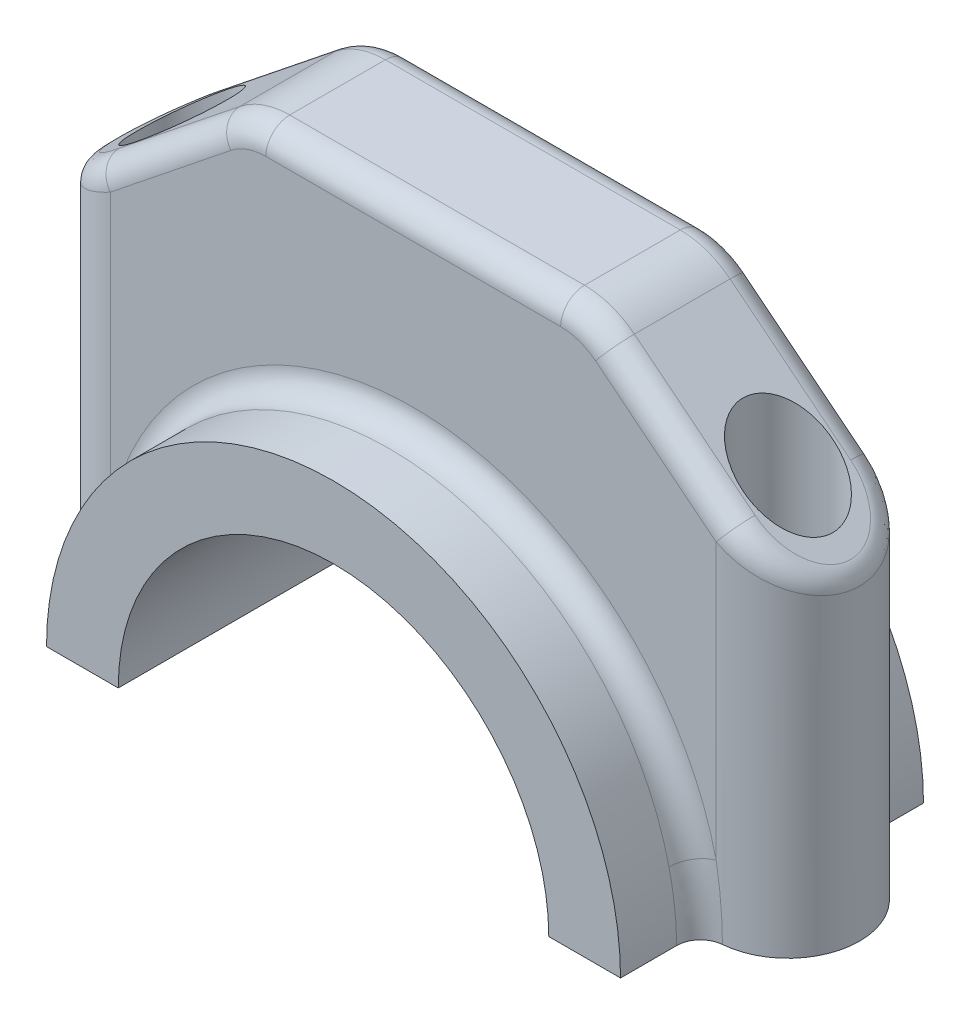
SolidWorks part; units mm, degrees
ref_plane "Front Plane" through (0, 0, 0) normal (0, 0, 1) x (1, 0, 0)
ref_plane "Top Plane" through (0, 0, 0) normal (0, 1, 0) x (1, 0, 0)
ref_plane "Right Plane" through (0, 0, 0) normal (1, 0, 0) x (0, 0, -1)
sketch "Sketch1" plane through (0, 0, 0) normal (0, 0, 1) x (1, 0, 0)
  line L0 (-36, 0) -> (-27, 0)
  line L1 (27, 0) -> (36, 0)
  arc A0 (27, 0) -> (-27, 0) centre (0, 0) ccw
  arc A1 (36, 0) -> (-36, 0) centre (0, 0) ccw
  dimension "D1" = 72
  dimension "D2" = 54
extrude "Boss-Extrude1" add sketch "Sketch1" along normal mid plane 38
ref_plane "Plane1" through (0, 60, 0) normal (0, -1, 0) x (-1, 0, 0)
sketch "Sketch2" plane through (0, 60, 0) normal (0, -1, 0) x (-1, 0, 0)
  line L0 (-38, 0) -> (38, 0) construction
  line L1 (-38, 9) -> (38, 9)
  line L2 (-38, -9) -> (38, -9)
  arc A0 (-38, 9) -> (-38, -9) centre (-38, 0) ccw
  arc A1 (38, -9) -> (38, 9) centre (38, 0) ccw
  point P2 (0, 0)
  dimension "D2" = 9
  dimension "D1" = 76
extrude "Boss-Extrude2" add sketch "Sketch2" along normal up to surface (60 mm away)
sketch "Sketch3" plane through (0, 0, 9) normal (0, 0, 1) x (1, 0, 0)
  line L1 (-27, 0) -> (27, 0)
  line L2 (-27, 0) -> (27, 0)
  arc A1 (27, 0) -> (-27, 0) centre (0, 0) ccw
  arc A2 (27, 0) -> (-27, 0) centre (0, 0) ccw
  dimension "D1" = 0
extrude "Cut-Extrude1" cut sketch "Sketch3" against normal through all both and the other way through all
sketch "Sketch5" plane through (0, 60, 0) normal (0, -1, 0) x (-1, 0, 0)
  line L0 (0, 0) -> (0, -32.8859) construction
  circle A0 centre (38, 0) radius 5.6298
  circle A1 centre (-38, 0) radius 5.6298
  dimension "D1" = 11.2595
extrude "Cut-Extrude3" cut sketch "Sketch5" along normal through all
sketch "Sketch6" plane through (0, 0, 0) normal (0, 0, 1) x (1, 0, 0)
  line L0 (-47, 40) -> (-47, 60)
  line L1 (-47, 60) -> (-47, 0) construction
  line L2 (-11, 60) -> (11, 60) construction
  line L3 (-47, 60) -> (-22, 60)
  line L4 (-22, 60) -> (-47, 40)
  line L5 (0, 0) -> (0, 25.7811) construction
  line L6 (22, 60) -> (47, 40)
  line L7 (47, 60) -> (22, 60)
  line L8 (47, 40) -> (47, 60)
  dimension "D1" = 20
  dimension "D2" = 25
extrude "Cut-Extrude4" cut sketch "Sketch6" against normal through all both and the other way through all
fillet "Fillet1" radius 10 2 edges at (-22, 60, 0) (22, 60, 0)
fillet "Fillet2" radius 3 2 edges at (0, 36, 9) (0, 36, -9)
fillet "Fillet3" radius 3 12 edges at (21.8023, 59.4363, 9) (31.3696, 52.5043, 9) (47, 40, 0) (31.3696, 52.5043, -9) (21.8023, 59.4363, -9) (0, 60, -9) (-21.8023, 59.4363, -9) (-31.3696, 52.5043, -9) (-47, 40, 0) (-31.3696, 52.5043, 9) (-21.8023, 59.4363, 9) (0, 60, 9)
